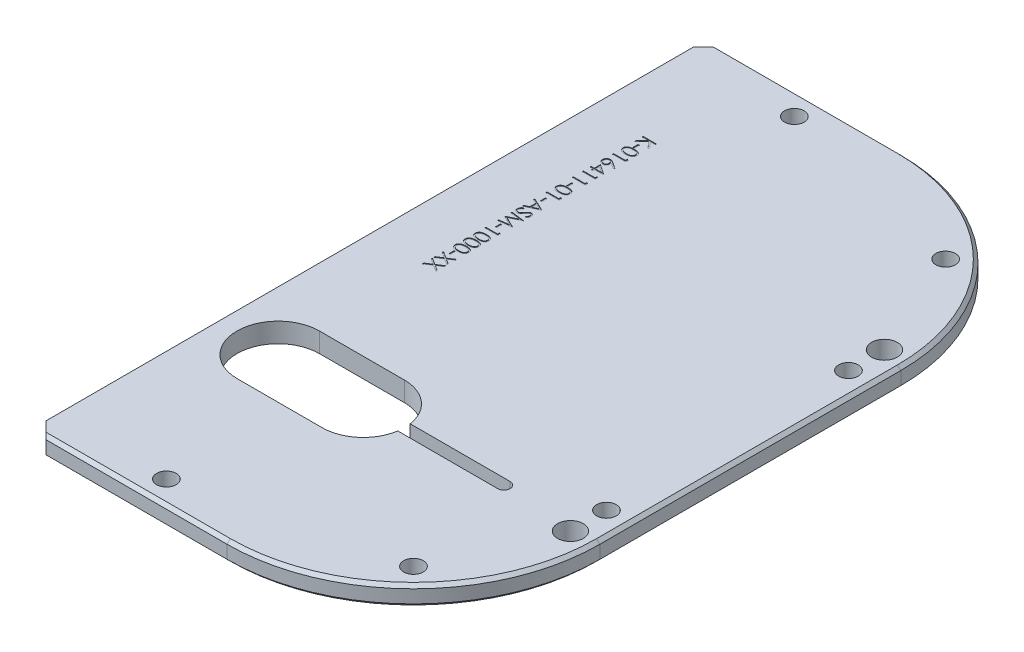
SolidWorks part; units mm, degrees
ref_plane "Front Plane" through (0, 0, 0) normal (0, 0, 1) x (1, 0, 0)
ref_plane "Top Plane" through (0, 0, 0) normal (0, 1, 0) x (1, 0, 0)
ref_plane "Right Plane" through (0, 0, 0) normal (1, 0, 0) x (0, 0, -1)
sketch "Sketch1" plane through (0, 0, 0) normal (0, 1, 0) x (1, 0, 0)
  line L1 (-127, 165.1) -> (127, 165.1)
  line L2 (-127, 165.1) -> (-127, -165.1)
  line L3 (-127, -165.1) -> (127, -165.1)
  line L4 (127, 165.1) -> (127, -165.1)
  line L5 (-127, 165.1) -> (127, -165.1) construction
  line L6 (-127, -165.1) -> (127, 165.1) construction
  point P0 (0, 0)
  dimension "D1" = 330.2
  dimension "D2" = 254
extrude "Boss-Extrude1" add sketch "Sketch1" along normal mid plane 9.525
sketch "Sketch2" plane through (0, 4.7625, 0) normal (0, 1, 0) x (1, 0, 0)
  line L0 (56.1304, -73.025) -> (56.1304, 73.025) construction
  line L1 (-32.7696, 161.925) -> (-247.2091, 161.925) construction
  line L3 (-127, -161.925) -> (-32.7696, -161.925)
  line L4 (56.1304, -73.025) -> (56.1304, 73.025)
  line L5 (-32.7696, 161.925) -> (-127, 161.925)
  line L6 (-127, 161.925) -> (-127, -161.925)
  line L7 (-127, 165.1) -> (-127, -165.1) construction
  line L8 (0, 0) -> (-127, 0) construction
  arc A0 (-32.7696, -161.925) -> (56.1304, -73.025) centre (-32.7696, -73.025) ccw construction
  arc A5 (-32.7696, -161.925) -> (56.1304, -73.025) centre (-32.7696, -73.025) ccw
  arc A6 (56.1304, 73.025) -> (-32.7696, 161.925) centre (-32.7696, 73.025) ccw
extrude "Cut-Extrude1" cut sketch "Sketch2" against normal blind 9.525 flip side to cut
sketch "Sketch3" plane through (0, 4.7625, 0) normal (0, 1, 0) x (1, 0, 0)
  line L0 (-42.8625, -73.025) -> (11.1125, -73.025) construction
  line L1 (-42.8625, -70.01) -> (11.1125, -70.01)
  line L2 (-42.8625, -76.04) -> (11.1125, -76.04)
  line L3 (-127, 161.925) -> (-127, -161.925) construction
  arc A0 (-42.8625, -70.01) -> (-42.8625, -76.04) centre (-42.8625, -73.025) ccw
  arc A1 (11.1125, -76.04) -> (11.1125, -70.01) centre (11.1125, -73.025) ccw
  point P2 (-15.875, -73.025)
  dimension "D1" = 6.03
  dimension "D2" = 53.975
  dimension "D3" = 73.025
  dimension "D4" = 84.1375
extrude "Cut-Extrude2" cut sketch "Sketch3" against normal through all
sketch "Sketch4" plane through (0, 4.7625, 0) normal (0, 1, 0) x (1, 0, 0)
  line L0 (-98.425, -73.025) -> (-57.15, -73.025) construction
  line L1 (-98.425, -53.025) -> (-57.15, -53.025)
  line L2 (-98.425, -93.025) -> (-57.15, -93.025)
  line L3 (-127, 161.925) -> (-127, -161.925) construction
  arc A0 (-98.425, -53.025) -> (-98.425, -93.025) centre (-98.425, -73.025) ccw
  arc A1 (-57.15, -93.025) -> (-57.15, -53.025) centre (-57.15, -73.025) ccw
  point P2 (-77.7875, -73.025)
  dimension "D1" = 40
  dimension "D2" = 41.275
  dimension "D3" = 73.025
  dimension "D4" = 28.575
extrude "Cut-Extrude3" cut sketch "Sketch4" against normal through all
fillet "Fillet3" [suppressed] radius 9.525
chamfer "Chamfer1" [suppressed] distance 1.5875 angle 45
hole_wizard "Hole1" positions "Sketch6" profile "Sketch5" legacy
sketch "Sketch6" plane through (0, 4.7625, 0) normal (0, 1, 0) x (1, 0, 0)
  circle A0 centre (-73.3144, 152.4) radius 2.5527 construction
  point P0 (-73.3144, 152.4)
  point P3 (23.357, 129.1516)
  point P6 (46.6054, 58.7375)
  point P9 (46.6054, -58.7375)
  point P12 (23.357, -129.1516)
  point P15 (-73.3144, -152.4)
sketch "Sketch5" plane through (-73.3144, 4.7625, -152.4) normal (1, 0, 0) x (0, 0, 1)
  line L0 (0, 0) -> (0, 88.9)
  line L1 (0, 88.9) -> (4.7625, 88.9)
  line L2 (4.7625, 88.9) -> (4.7625, 0)
  line L3 (4.7625, 0) -> (0, 0)
  line L4 (0, 110) -> (0, -10) construction
  dimension "Diameter" = 9.525
  dimension "Depth" = 88.9
sketch "Sketch7" plane through (0, 4.7625, 0) normal (0, 1, 0) x (1, 0, 0)
  line L0 (-101.6, 130.175) -> (-101.6, -22.225) construction
  line L1 (-127, 161.925) -> (-127, -161.925) construction
  line L2 (-32.7696, 161.925) -> (-127, 161.925) construction
  text T0 "K-016411-01-ASM-1000-XX" font "Century Gothic" height in points 24
  dimension "D1" = 25.4
  dimension "D2" = 152.4
  dimension "D3" = 31.75
extrude "Cut-Extrude4" cut sketch "Sketch7" against normal blind 0.254
other "Move Face1" parameters "D1"=1.5875
chamfer "Chamfer2" distance 1.5875 angle 45 10 edges at (-79.8848, -4.7625, 163.5125) (31.2147, -4.7625, 137.0093) (57.7179, -4.7625, 0) (31.2147, -4.7625, -137.0093) (-79.8848, -4.7625, -163.5125) (-79.8848, 4.7625, 163.5125) (31.2147, 4.7625, 137.0093) (57.7179, 4.7625, 0) (31.2147, 4.7625, -137.0093) (-79.8848, 4.7625, -163.5125)
hole_wizard "M12 Clearance Hole1" positions "Sketch9" profile "Sketch8" hole size "M12" standard "ANSI Metric"
sketch "Sketch9" plane through (0, 4.7625, 0) normal (0, 1, 0) x (1, 0, 0)
  circle A0 centre (46.6054, 76.2) radius 3.302 construction
  circle A1 centre (46.6054, -76.2) radius 3.302 construction
  point P0 (46.6054, 76.2)
  point P1 (46.6054, -76.2)
sketch "Sketch8" plane through (46.6054, 4.7625, -76.2) normal (1, 0, 0) x (0, 0, 1)
  line L0 (0, 0) -> (0, 9.525)
  line L1 (0, 9.525) -> (6.25, 9.525)
  line L2 (6.25, 9.525) -> (6.25, 0)
  line L5 (6.25, 0) -> (0, 0)
  line L11 (0, -6.35) -> (0, 107.95) construction
  dimension "Thru Hole Dia." = 12.5
  dimension "Thru Hole Depth" = 9.525
chamfer "Chamfer3" distance 6.35 angle 45 2 edges at (-127, 0, -163.5125) (-127, 0, 163.5125)
